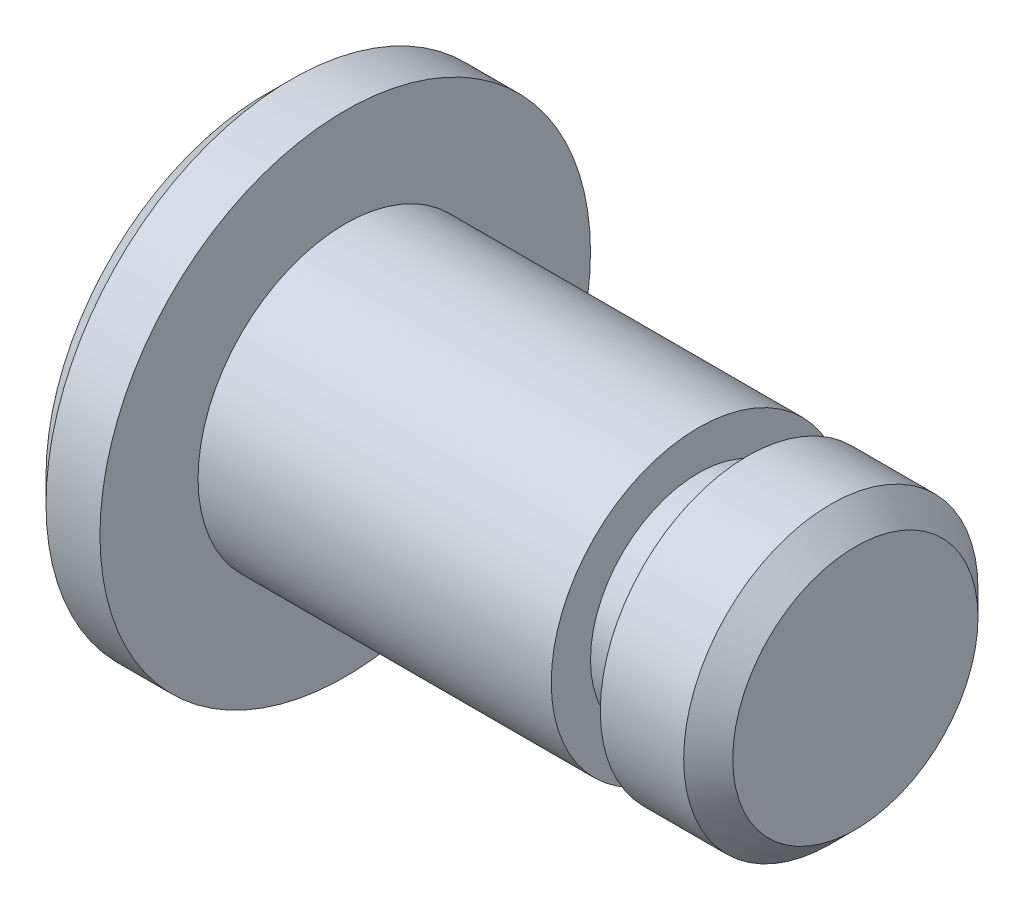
SolidWorks part; units mm, degrees
ref_plane "Face" through (0, 0, 0) normal (0, 0, 1) x (1, 0, 0)
ref_plane "Dessus" through (0, 0, 0) normal (0, 1, 0) x (1, 0, 0)
ref_plane "Droite" through (0, 0, 0) normal (1, 0, 0) x (0, 0, -1)
sketch "Esquisse1" plane through (0, 0, 0) normal (0, 0, 1) x (1, 0, 0)
  line L0 (-30.3011, 0) -> (65.3245, 0) construction
  line L1 (0, 1.5) -> (0, 2.5)
  line L2 (0, 2.5) -> (-0.8, 2.5)
  line L3 (-0.8, 2.5) -> (-0.8, 0)
  line L4 (0, 1.5) -> (5.2, 1.5)
  line L5 (5.2, 1.5) -> (5.2, 0)
  line L6 (-0.8, 0) -> (5.2, 0)
  dimension "D1" = 3
  dimension "D2" = 5
  dimension "D3" = 0.8
  dimension "D4" = 5.2
revolve "Base-Révolution" add sketch "Esquisse1" angle 360 about L0
chamfer "Chanfrein1" distance 0.25 angle 45
sketch "Esquisse2" plane through (0, 0, 0) normal (0, 0, 1) x (1, 0, 0)
  line L0 (0, 0) -> (5.4812, 0) construction
  line L1 (3.6, 5) -> (4.1, 5)
  line L2 (3.6, 5) -> (3.6, 1.1)
  line L3 (3.6, 1.1) -> (4.1, 1.1)
  line L4 (4.1, 5) -> (4.1, 1.1)
  line L5 (0, -2.5) -> (0, 2.5) construction
  dimension "D1" = 3.6
  dimension "D2" = 0.5
  dimension "D3" = 2.2
  dimension "D4" = 10
revolve "Enlèvement de matière-Révolution1" cut sketch "Esquisse2" angle 360 about L0
